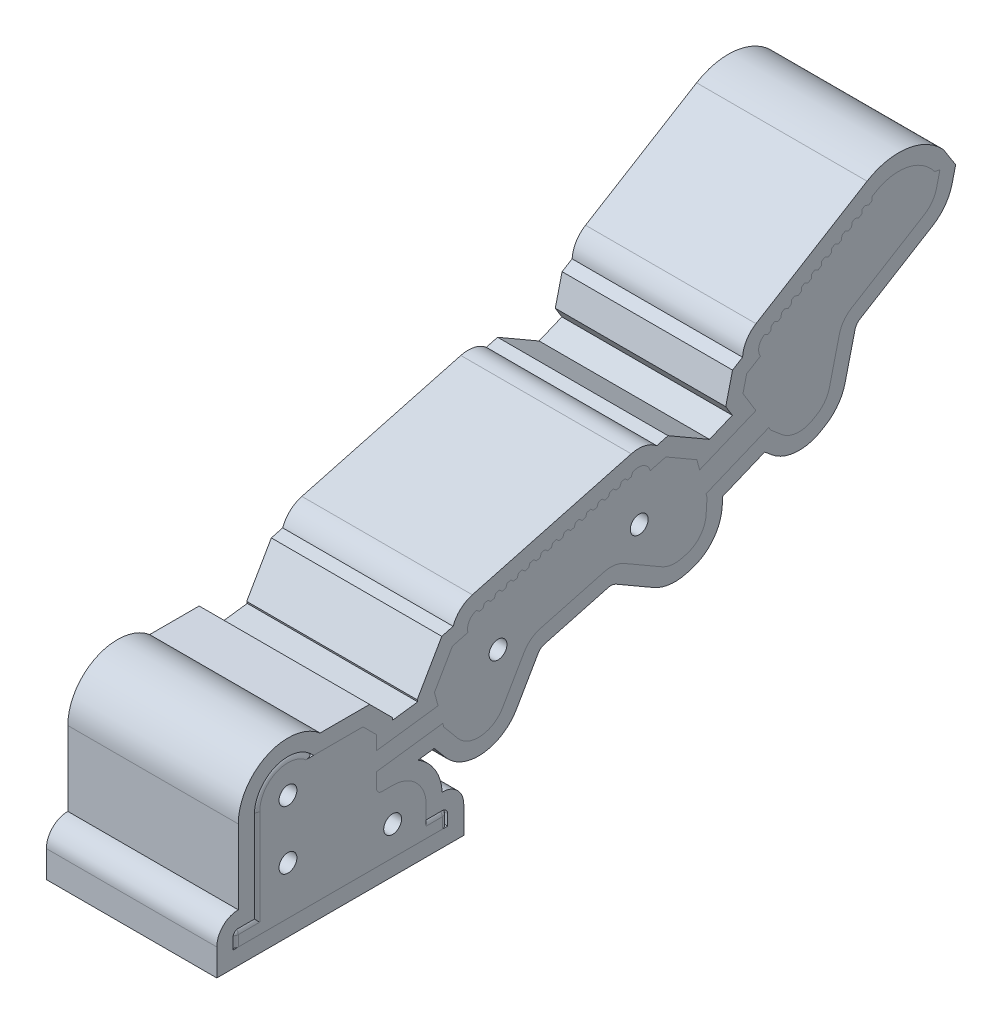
SolidWorks part; units mm, degrees
other "<finger_flexure>-<Wall Removal[3]>"
other "<finger_flexure>-<Wall Removal[2]>"
other "<finger_flexure>-<Wall Removal[1]>"
other "<finger_flexure>-<Pad Material[4]>"
other "<finger_flexure>-<Pad Material[3]>"
other "<finger_flexure>-<Pad Material[2]>"
other "<finger_flexure>-<Pad Material[1]>"
ref_plane "Front Plane" through (0, 0, 0) normal (0, 0, 1) x (1, 0, 0)
ref_plane "Top Plane" through (0, 0, 0) normal (0, 1, 0) x (1, 0, 0)
ref_plane "Right Plane" through (0, 0, 0) normal (1, 0, 0) x (0, 0, -1)
inserted part "finger_flexure"
combine bodies "Union" operation type add bodies to combine 107 103 105 102 104 106 101
sketch "Sketch2" plane through (15.875, 0, 0) normal (1, 0, 0) x (0, 0, -1)
  line L0 (116.3122, 42.9188) -> (119.2429, 42.2748) construction
  line L1 (116.9789, 45.8438) -> (119.2429, 42.2748)
  line L2 (-11.375, 2.75) -> (-11.375, -14.1005) construction
  line L3 (82.0558, 35.2325) -> (102.741, 47.8696)
  line L4 (-11.375, -14.1005) -> (-14.375, -14.1005) construction
  line L5 (-15.375, -17.1005) -> (-14.375, -17.1005) construction
  line L7 (-15.375, -15.1005) -> (-15.375, -17.1005) construction
  line L8 (23.625, -17.1005) -> (24.625, -17.1005) construction
  line L9 (24.625, -17.1005) -> (24.625, -15.1005) construction
  line L10 (118.5807, 39.5327) -> (119.2429, 42.2748)
  line L11 (101.4017, 26.2918) -> (114.9749, 34.5841)
  line L12 (98.639, 17.3484) -> (100.5002, 25.0546)
  line L13 (23.625, -14.1005) -> (20.625, -14.1005) construction
  line L14 (94.2716, 11.9344) -> (95.0333, 12.3997)
  line L15 (83.6693, 13.7193) -> (84.9456, 12.6437)
  line L16 (-11.375, 2.75) -> (-11.375, -14.1005)
  line L17 (83.6693, 13.7193) -> (83.6693, 13.7193)
  line L18 (-11.375, -14.1005) -> (-14.375, -14.1005)
  line L19 (-15.375, -17.1005) -> (-14.375, -17.1005)
  line L20 (75.8558, 10.4828) -> (83.6693, 13.7193)
  line L21 (-15.375, -15.1005) -> (-15.375, -17.1005)
  line L22 (23.625, -17.1005) -> (24.625, -17.1005)
  line L23 (24.625, -17.1005) -> (24.625, -15.1005)
  line L24 (75.8558, 10.4828) -> (75.8558, 10.4828)
  line L25 (75.7557, 8.8571) -> (75.8558, 10.4828)
  line L26 (69.0467, 1.4082) -> (69.8414, 1.6211)
  line L27 (23.625, -14.1005) -> (20.625, -14.1005)
  line L28 (56.0202, 6.2234) -> (62.9762, 2.2074)
  line L29 (42.6761, 3.2543) -> (54.5026, 6.4232)
  line L30 (37.4457, -4.6335) -> (41.4617, 2.3225)
  line L31 (32.4243, -8.4048) -> (32.588, -8.3609)
  line L32 (22.1192, -3.3059) -> (24.2215, -5.8151)
  line L33 (22.1192, -3.3059) -> (22.1192, -3.3059)
  line L34 (19.1069, -3.7025) -> (22.1192, -3.3059)
  line L35 (19.1069, -3.7025) -> (19.1069, -3.7025)
  line L36 (19.1069, -3.7025) -> (19.1069, -3.7025)
  line L37 (23.6086, -11.1005) -> (23.6086, -11.1005)
  line L38 (23.625, -11.1005) -> (23.6086, -11.1005)
  line L39 (27.625, -20.1005) -> (27.625, -15.1005)
  line L40 (23.625, -20.1005) -> (27.625, -20.1005)
  line L41 (-14.375, -20.1005) -> (23.625, -20.1005)
  line L42 (-18.375, -20.1005) -> (-14.375, -20.1005)
  line L43 (-18.375, -15.1005) -> (-18.375, -20.1005)
  line L44 (-14.375, -11.1005) -> (-14.375, -11.1005)
  line L45 (-14.375, 2.75) -> (-14.375, -11.1005)
  line L46 (10.0904, 9.8) -> (0.8633, 9.8)
  line L47 (14.375, 5.5154) -> (10.0904, 9.8)
  line L48 (14.375, 5.1153) -> (14.375, 5.5154)
  line L49 (19.0506, 5.7309) -> (14.375, 5.1153)
  line L50 (18.9471, 6.1173) -> (19.0506, 5.7309)
  line L51 (23.5324, 14.0593) -> (18.9471, 6.1173)
  line L52 (25.6421, 14.6246) -> (23.5324, 14.0593)
  line L53 (29.2214, 17.9131) -> (58.8253, 25.8454)
  line L54 (65.6791, 25.3525) -> (63.5693, 24.7872)
  line L55 (73.3989, 20.8954) -> (65.6791, 25.3525)
  line L56 (73.3989, 20.8954) -> (73.3989, 20.8954)
  line L57 (77.6453, 22.6543) -> (73.3989, 20.8954)
  line L58 (76.4172, 24.6646) -> (77.6453, 22.6543)
  line L59 (77.6883, 29.9276) -> (76.4172, 24.6646)
  line L60 (79.5522, 31.0663) -> (77.6883, 29.9276)
  line L61 (118.5807, 39.5327) -> (119.9474, 45.1915) construction
  line L141 (11.375, -4.4005) -> (11.375, -1.6945)
  line L142 (11.375, -1.6945) -> (23.7109, -0.0704)
  line L143 (23.7109, -0.0704) -> (23.8936, -0.7524)
  line L144 (23.8936, -0.7524) -> (26.5211, -3.8884)
  line L145 (31.6478, -5.507) -> (31.8116, -5.4631)
  line L146 (34.8476, -3.1335) -> (38.8636, 3.8225)
  line L147 (41.8997, 6.1521) -> (53.7261, 9.321)
  line L148 (57.5202, 8.8215) -> (64.4762, 4.8055)
  line L149 (68.2703, 4.306) -> (69.0649, 4.5189)
  line L150 (72.7614, 9.0414) -> (72.9287, 11.7598)
  line L151 (72.9287, 11.7598) -> (72.746, 12.4418)
  line L152 (72.746, 12.4418) -> (84.4406, 17.2859)
  line L153 (84.4406, 17.2859) -> (84.81, 16.6812)
  line L154 (84.81, 16.6812) -> (86.8789, 14.9378)
  line L155 (92.7076, 14.4944) -> (93.4693, 14.9598)
  line L156 (95.7229, 18.0527) -> (97.5841, 25.7589)
  line L157 (99.8376, 28.8518) -> (113.4109, 37.1441)
  line L158 (115.6645, 40.237) -> (116.3122, 42.9188)
  line L159 (116.3122, 42.9188) -> (115.3247, 43.1358)
  line L160 (104.305, 45.3096) -> (103.6736, 44.9238)
  line L161 (103.6736, 44.9238) -> (103.6317, 44.2251)
  line L162 (103.6317, 44.2251) -> (103.0344, 43.8602)
  line L163 (103.0344, 43.8602) -> (102.3936, 44.1418)
  line L164 (102.3936, 44.1418) -> (101.7962, 43.7769)
  line L165 (101.7962, 43.7769) -> (101.7544, 43.0782)
  line L166 (101.7544, 43.0782) -> (101.157, 42.7132)
  line L167 (101.157, 42.7132) -> (100.5162, 42.9949)
  line L168 (100.5162, 42.9949) -> (99.9189, 42.63)
  line L169 (99.9189, 42.63) -> (99.877, 41.9312)
  line L170 (99.877, 41.9312) -> (99.2796, 41.5663)
  line L171 (99.2796, 41.5663) -> (98.6388, 41.848)
  line L172 (98.6388, 41.848) -> (98.0415, 41.483)
  line L173 (98.0415, 41.483) -> (97.9996, 40.7843)
  line L174 (97.9996, 40.7843) -> (97.4023, 40.4193)
  line L175 (97.4023, 40.4193) -> (96.7615, 40.701)
  line L176 (96.7615, 40.701) -> (96.1641, 40.3361)
  line L177 (96.1641, 40.3361) -> (96.1222, 39.6373)
  line L178 (96.1222, 39.6373) -> (95.5249, 39.2724)
  line L179 (95.5249, 39.2724) -> (94.8841, 39.5541)
  line L180 (94.8841, 39.5541) -> (94.2867, 39.1891)
  line L181 (94.2867, 39.1891) -> (94.2449, 38.4904)
  line L182 (94.2449, 38.4904) -> (93.6475, 38.1255)
  line L183 (93.6475, 38.1255) -> (93.0067, 38.4071)
  line L184 (93.0067, 38.4071) -> (92.4094, 38.0422)
  line L185 (92.4094, 38.0422) -> (92.3675, 37.3435)
  line L186 (92.3675, 37.3435) -> (91.7702, 36.9785)
  line L187 (91.7702, 36.9785) -> (91.1293, 37.2602)
  line L188 (91.1293, 37.2602) -> (90.532, 36.8953)
  line L189 (90.532, 36.8953) -> (90.4901, 36.1965)
  line L190 (90.4901, 36.1965) -> (89.8928, 35.8316)
  line L191 (89.8928, 35.8316) -> (89.252, 36.1133)
  line L192 (89.252, 36.1133) -> (88.6546, 35.7483)
  line L193 (88.6546, 35.7483) -> (88.6128, 35.0496)
  line L194 (88.6128, 35.0496) -> (88.0154, 34.6846)
  line L195 (88.0154, 34.6846) -> (87.3746, 34.9663)
  line L196 (87.3746, 34.9663) -> (86.7772, 34.6014)
  line L197 (86.7772, 34.6014) -> (86.7354, 33.9026)
  line L198 (86.7354, 33.9026) -> (86.138, 33.5377)
  line L199 (86.138, 33.5377) -> (85.4972, 33.8194)
  line L200 (85.4972, 33.8194) -> (84.8999, 33.4545)
  line L201 (84.8999, 33.4545) -> (84.858, 32.7557)
  line L202 (84.858, 32.7557) -> (84.2607, 32.3908)
  line L203 (84.2607, 32.3908) -> (83.6198, 32.6725)
  line L204 (82.8728, 29.5794) -> (80.3127, 28.0154)
  line L205 (80.3127, 28.0154) -> (79.6251, 25.1682)
  line L206 (79.6251, 25.1682) -> (82.034, 21.225)
  line L207 (82.034, 21.225) -> (71.5555, 16.8847)
  line L208 (71.5555, 16.8847) -> (71.0449, 18.7904)
  line L209 (71.0449, 18.7904) -> (65.2552, 22.1331)
  line L210 (65.2552, 22.1331) -> (62.3575, 21.3566)
  line L211 (59.6018, 22.9476) -> (59.0722, 22.8057)
  line L212 (59.0722, 22.8057) -> (58.8346, 22.1473)
  line L213 (58.8346, 22.1473) -> (58.1584, 21.9661)
  line L214 (58.1584, 21.9661) -> (57.6234, 22.4175)
  line L215 (57.6234, 22.4175) -> (56.9472, 22.2363)
  line L216 (56.9472, 22.2363) -> (56.7095, 21.5779)
  line L217 (56.7095, 21.5779) -> (56.0334, 21.3967)
  line L218 (56.0334, 21.3967) -> (55.4983, 21.8481)
  line L219 (55.4983, 21.8481) -> (54.8222, 21.6669)
  line L220 (54.8222, 21.6669) -> (54.5845, 21.0085)
  line L221 (54.5845, 21.0085) -> (53.9083, 20.8273)
  line L222 (53.9083, 20.8273) -> (53.3733, 21.2787)
  line L223 (53.3733, 21.2787) -> (52.6971, 21.0975)
  line L224 (52.6971, 21.0975) -> (52.4594, 20.4391)
  line L225 (52.4594, 20.4391) -> (51.7833, 20.2579)
  line L226 (51.7833, 20.2579) -> (51.2482, 20.7093)
  line L227 (51.2482, 20.7093) -> (50.5721, 20.5281)
  line L228 (50.5721, 20.5281) -> (50.3344, 19.8697)
  line L229 (50.3344, 19.8697) -> (49.6583, 19.6885)
  line L230 (49.6583, 19.6885) -> (49.1232, 20.1399)
  line L231 (49.1232, 20.1399) -> (48.4471, 19.9587)
  line L232 (48.4471, 19.9587) -> (48.2094, 19.3003)
  line L233 (48.2094, 19.3003) -> (47.5332, 19.1191)
  line L234 (47.5332, 19.1191) -> (46.9982, 19.5705)
  line L235 (46.9982, 19.5705) -> (46.322, 19.3893)
  line L236 (46.322, 19.3893) -> (46.0843, 18.7309)
  line L237 (46.0843, 18.7309) -> (45.4082, 18.5497)
  line L238 (45.4082, 18.5497) -> (44.8731, 19.0011)
  line L239 (44.8731, 19.0011) -> (44.197, 18.8199)
  line L240 (44.197, 18.8199) -> (43.9593, 18.1615)
  line L241 (43.9593, 18.1615) -> (43.2832, 17.9803)
  line L242 (43.2832, 17.9803) -> (42.7481, 18.4317)
  line L243 (42.7481, 18.4317) -> (42.072, 18.2505)
  line L244 (42.072, 18.2505) -> (41.8343, 17.5921)
  line L245 (41.8343, 17.5921) -> (41.1581, 17.4109)
  line L246 (41.1581, 17.4109) -> (40.6231, 17.8623)
  line L247 (40.6231, 17.8623) -> (39.9469, 17.6811)
  line L248 (39.9469, 17.6811) -> (39.7092, 17.0227)
  line L249 (39.7092, 17.0227) -> (39.0331, 16.8415)
  line L250 (39.0331, 16.8415) -> (38.498, 17.2929)
  line L251 (38.498, 17.2929) -> (37.8219, 17.1117)
  line L252 (37.8219, 17.1117) -> (37.5842, 16.4533)
  line L253 (37.5842, 16.4533) -> (36.908, 16.2721)
  line L254 (36.908, 16.2721) -> (36.373, 16.7235)
  line L255 (36.373, 16.7235) -> (35.6968, 16.5423)
  line L256 (35.6968, 16.5423) -> (35.4592, 15.8839)
  line L257 (35.4592, 15.8839) -> (34.783, 15.7027)
  line L258 (34.783, 15.7027) -> (34.248, 16.1541)
  line L259 (34.248, 16.1541) -> (33.5718, 15.9729)
  line L260 (33.5718, 15.9729) -> (33.3341, 15.3145)
  line L261 (33.3341, 15.3145) -> (32.658, 15.1333)
  line L262 (32.658, 15.1333) -> (32.1229, 15.5847)
  line L263 (32.1229, 15.5847) -> (31.4468, 15.4035)
  line L264 (31.4468, 15.4035) -> (31.2091, 14.7451)
  line L265 (31.2091, 14.7451) -> (30.5329, 14.5639)
  line L266 (30.5329, 14.5639) -> (29.9979, 15.0153)
  line L267 (28.4069, 12.2596) -> (25.5091, 11.4831)
  line L268 (25.5091, 11.4831) -> (22.1665, 5.6935)
  line L269 (22.1665, 5.6935) -> (22.8338, 3.2031)
  line L270 (22.8338, 3.2031) -> (11.375, 1.6945)
  line L271 (11.375, 1.6945) -> (11.375, 4.2728)
  line L272 (11.375, 4.2728) -> (8.8478, 6.8)
  line L273 (8.8478, 6.8) -> (-1.7843, 6.8)
  line L274 (-10.375, 2.75) -> (-10.375, -15.1005)
  line L275 (-10.375, -15.1005) -> (-14.375, -15.1005)
  line L276 (-14.375, -15.1005) -> (-14.375, -17.1005)
  line L277 (-14.375, -17.1005) -> (23.625, -17.1005)
  line L278 (23.625, -17.1005) -> (23.625, -15.1005)
  line L279 (23.625, -15.1005) -> (20.625, -15.1005)
  line L280 (20.625, -15.1005) -> (20.625, -11.6505)
  line L281 (14.375, -5.4005) -> (12.375, -5.4005)
  line L282 (11.375, -4.4005) -> (11.375, -1.6945)
  line L283 (11.375, -1.6945) -> (23.7109, -0.0704)
  line L284 (23.7109, -0.0704) -> (23.8936, -0.7524)
  line L285 (23.8936, -0.7524) -> (26.5211, -3.8884)
  line L286 (31.6478, -5.507) -> (31.8116, -5.4631)
  line L287 (34.8476, -3.1335) -> (38.8636, 3.8225)
  line L288 (41.8997, 6.1521) -> (53.7261, 9.321)
  line L289 (57.5202, 8.8215) -> (64.4762, 4.8055)
  line L290 (68.2703, 4.306) -> (69.0649, 4.5189)
  line L291 (72.7614, 9.0414) -> (72.9287, 11.7598)
  line L292 (72.9287, 11.7598) -> (72.746, 12.4418)
  line L293 (72.746, 12.4418) -> (84.4406, 17.2859)
  line L294 (84.4406, 17.2859) -> (84.81, 16.6812)
  line L295 (84.81, 16.6812) -> (86.8789, 14.9378)
  line L296 (92.7076, 14.4944) -> (93.4693, 14.9598)
  line L297 (95.7229, 18.0527) -> (97.5841, 25.7589)
  line L298 (99.8376, 28.8518) -> (113.4109, 37.1441)
  line L299 (115.6645, 40.237) -> (116.3122, 42.9188)
  line L300 (116.3122, 42.9188) -> (115.3247, 43.1358)
  line L345 (82.8728, 29.5794) -> (80.3127, 28.0154)
  line L346 (80.3127, 28.0154) -> (79.6251, 25.1682)
  line L347 (79.6251, 25.1682) -> (82.034, 21.225)
  line L348 (82.034, 21.225) -> (71.5555, 16.8847)
  line L349 (71.5555, 16.8847) -> (71.0449, 18.7904)
  line L350 (71.0449, 18.7904) -> (65.2552, 22.1331)
  line L351 (65.2552, 22.1331) -> (62.3575, 21.3566)
  line L408 (28.4069, 12.2596) -> (25.5091, 11.4831)
  line L409 (25.5091, 11.4831) -> (22.1665, 5.6935)
  line L410 (22.1665, 5.6935) -> (22.8338, 3.2031)
  line L411 (22.8338, 3.2031) -> (11.375, 1.6945)
  line L412 (11.375, 1.6945) -> (11.375, 4.2728)
  line L413 (11.375, 4.2728) -> (8.8478, 6.8)
  line L414 (8.8478, 6.8) -> (-0.3647, 6.8)
  line L418 (-14.375, -17.1005) -> (23.625, -17.1005)
  line L421 (20.625, -14.1005) -> (20.625, -11.6505)
  line L422 (14.375, -5.4005) -> (12.375, -5.4005)
  line L423 (29.9979, 15.0153) -> (59.6018, 22.9476) construction
  line L424 (83.6198, 32.6725) -> (104.305, 45.3096) construction
  line L661 (11.375, -4.4005) -> (11.375, -1.6945)
  line L662 (11.375, -1.6945) -> (23.7109, -0.0704)
  line L663 (23.7109, -0.0704) -> (23.8936, -0.7524)
  line L664 (23.8936, -0.7524) -> (26.5211, -3.8884)
  line L665 (31.6478, -5.507) -> (31.8116, -5.4631)
  line L666 (34.8476, -3.1335) -> (38.8636, 3.8225)
  line L667 (41.8997, 6.1521) -> (53.7261, 9.321)
  line L668 (57.5202, 8.8215) -> (64.4762, 4.8055)
  line L669 (68.2703, 4.306) -> (69.0649, 4.5189)
  line L670 (72.7614, 9.0414) -> (72.9287, 11.7598)
  line L671 (72.9287, 11.7598) -> (72.746, 12.4418)
  line L672 (72.746, 12.4418) -> (84.4406, 17.2859)
  line L673 (84.4406, 17.2859) -> (84.81, 16.6812)
  line L674 (84.81, 16.6812) -> (86.8789, 14.9378)
  line L675 (92.7076, 14.4944) -> (93.4693, 14.9598)
  line L676 (95.7229, 18.0527) -> (97.5841, 25.7589)
  line L677 (99.8376, 28.8518) -> (113.4109, 37.1441)
  line L678 (115.6645, 40.237) -> (116.3122, 42.9188)
  line L679 (116.3122, 42.9188) -> (115.3247, 43.1358)
  line L680 (104.305, 45.3096) -> (103.6736, 44.9238)
  line L681 (103.6736, 44.9238) -> (103.6317, 44.2251)
  line L682 (103.6317, 44.2251) -> (103.0344, 43.8602)
  line L683 (103.0344, 43.8602) -> (102.3936, 44.1418)
  line L684 (102.3936, 44.1418) -> (101.7962, 43.7769)
  line L685 (101.7962, 43.7769) -> (101.7544, 43.0782)
  line L686 (101.7544, 43.0782) -> (101.157, 42.7132)
  line L687 (101.157, 42.7132) -> (100.5162, 42.9949)
  line L688 (100.5162, 42.9949) -> (99.9189, 42.63)
  line L689 (99.9189, 42.63) -> (99.877, 41.9312)
  line L690 (99.877, 41.9312) -> (99.2796, 41.5663)
  line L691 (99.2796, 41.5663) -> (98.6388, 41.848)
  line L692 (98.6388, 41.848) -> (98.0415, 41.483)
  line L693 (98.0415, 41.483) -> (97.9996, 40.7843)
  line L694 (97.9996, 40.7843) -> (97.4023, 40.4193)
  line L695 (97.4023, 40.4193) -> (96.7615, 40.701)
  line L696 (96.7615, 40.701) -> (96.1641, 40.3361)
  line L697 (96.1641, 40.3361) -> (96.1222, 39.6373)
  line L698 (96.1222, 39.6373) -> (95.5249, 39.2724)
  line L699 (95.5249, 39.2724) -> (94.8841, 39.5541)
  line L700 (94.8841, 39.5541) -> (94.2867, 39.1891)
  line L701 (94.2867, 39.1891) -> (94.2449, 38.4904)
  line L702 (94.2449, 38.4904) -> (93.6475, 38.1255)
  line L703 (93.6475, 38.1255) -> (93.0067, 38.4071)
  line L704 (93.0067, 38.4071) -> (92.4094, 38.0422)
  line L705 (92.4094, 38.0422) -> (92.3675, 37.3435)
  line L706 (92.3675, 37.3435) -> (91.7702, 36.9785)
  line L707 (91.7702, 36.9785) -> (91.1293, 37.2602)
  line L708 (91.1293, 37.2602) -> (90.532, 36.8953)
  line L709 (90.532, 36.8953) -> (90.4901, 36.1965)
  line L710 (90.4901, 36.1965) -> (89.8928, 35.8316)
  line L711 (89.8928, 35.8316) -> (89.252, 36.1133)
  line L712 (89.252, 36.1133) -> (88.6546, 35.7483)
  line L713 (88.6546, 35.7483) -> (88.6128, 35.0496)
  line L714 (88.6128, 35.0496) -> (88.0154, 34.6846)
  line L715 (88.0154, 34.6846) -> (87.3746, 34.9663)
  line L716 (87.3746, 34.9663) -> (86.7772, 34.6014)
  line L717 (86.7772, 34.6014) -> (86.7354, 33.9026)
  line L718 (86.7354, 33.9026) -> (86.138, 33.5377)
  line L719 (86.138, 33.5377) -> (85.4972, 33.8194)
  line L720 (85.4972, 33.8194) -> (84.8999, 33.4545)
  line L721 (84.8999, 33.4545) -> (84.858, 32.7557)
  line L722 (84.858, 32.7557) -> (84.2607, 32.3908)
  line L723 (84.2607, 32.3908) -> (83.6198, 32.6725)
  line L724 (82.8728, 29.5794) -> (80.3127, 28.0154)
  line L725 (80.3127, 28.0154) -> (79.6251, 25.1682)
  line L726 (79.6251, 25.1682) -> (82.034, 21.225)
  line L727 (82.034, 21.225) -> (71.5555, 16.8847)
  line L728 (71.5555, 16.8847) -> (71.0449, 18.7904)
  line L729 (71.0449, 18.7904) -> (65.2552, 22.1331)
  line L730 (65.2552, 22.1331) -> (62.3575, 21.3566)
  line L731 (59.6018, 22.9476) -> (59.0722, 22.8057)
  line L732 (59.0722, 22.8057) -> (58.8346, 22.1473)
  line L733 (58.8346, 22.1473) -> (58.1584, 21.9661)
  line L734 (58.1584, 21.9661) -> (57.6234, 22.4175)
  line L735 (57.6234, 22.4175) -> (56.9472, 22.2363)
  line L736 (56.9472, 22.2363) -> (56.7095, 21.5779)
  line L737 (56.7095, 21.5779) -> (56.0334, 21.3967)
  line L738 (56.0334, 21.3967) -> (55.4983, 21.8481)
  line L739 (55.4983, 21.8481) -> (54.8222, 21.6669)
  line L740 (54.8222, 21.6669) -> (54.5845, 21.0085)
  line L741 (54.5845, 21.0085) -> (53.9083, 20.8273)
  line L742 (53.9083, 20.8273) -> (53.3733, 21.2787)
  line L743 (53.3733, 21.2787) -> (52.6971, 21.0975)
  line L744 (52.6971, 21.0975) -> (52.4594, 20.4391)
  line L745 (52.4594, 20.4391) -> (51.7833, 20.2579)
  line L746 (51.7833, 20.2579) -> (51.2482, 20.7093)
  line L747 (51.2482, 20.7093) -> (50.5721, 20.5281)
  line L748 (50.5721, 20.5281) -> (50.3344, 19.8697)
  line L749 (50.3344, 19.8697) -> (49.6583, 19.6885)
  line L750 (49.6583, 19.6885) -> (49.1232, 20.1399)
  line L751 (49.1232, 20.1399) -> (48.4471, 19.9587)
  line L752 (48.4471, 19.9587) -> (48.2094, 19.3003)
  line L753 (48.2094, 19.3003) -> (47.5332, 19.1191)
  line L754 (47.5332, 19.1191) -> (46.9982, 19.5705)
  line L755 (46.9982, 19.5705) -> (46.322, 19.3893)
  line L756 (46.322, 19.3893) -> (46.0843, 18.7309)
  line L757 (46.0843, 18.7309) -> (45.4082, 18.5497)
  line L758 (45.4082, 18.5497) -> (44.8731, 19.0011)
  line L759 (44.8731, 19.0011) -> (44.197, 18.8199)
  line L760 (44.197, 18.8199) -> (43.9593, 18.1615)
  line L761 (43.9593, 18.1615) -> (43.2832, 17.9803)
  line L762 (43.2832, 17.9803) -> (42.7481, 18.4317)
  line L763 (42.7481, 18.4317) -> (42.072, 18.2505)
  line L764 (42.072, 18.2505) -> (41.8343, 17.5921)
  line L765 (41.8343, 17.5921) -> (41.1581, 17.4109)
  line L766 (41.1581, 17.4109) -> (40.6231, 17.8623)
  line L767 (40.6231, 17.8623) -> (39.9469, 17.6811)
  line L768 (39.9469, 17.6811) -> (39.7092, 17.0227)
  line L769 (39.7092, 17.0227) -> (39.0331, 16.8415)
  line L770 (39.0331, 16.8415) -> (38.498, 17.2929)
  line L771 (38.498, 17.2929) -> (37.8219, 17.1117)
  line L772 (37.8219, 17.1117) -> (37.5842, 16.4533)
  line L773 (37.5842, 16.4533) -> (36.908, 16.2721)
  line L774 (36.908, 16.2721) -> (36.373, 16.7235)
  line L775 (36.373, 16.7235) -> (35.6968, 16.5423)
  line L776 (35.6968, 16.5423) -> (35.4592, 15.8839)
  line L777 (35.4592, 15.8839) -> (34.783, 15.7027)
  line L778 (34.783, 15.7027) -> (34.248, 16.1541)
  line L779 (34.248, 16.1541) -> (33.5718, 15.9729)
  line L780 (33.5718, 15.9729) -> (33.3341, 15.3145)
  line L781 (33.3341, 15.3145) -> (32.658, 15.1333)
  line L782 (32.658, 15.1333) -> (32.1229, 15.5847)
  line L783 (32.1229, 15.5847) -> (31.4468, 15.4035)
  line L784 (31.4468, 15.4035) -> (31.2091, 14.7451)
  line L785 (31.2091, 14.7451) -> (30.5329, 14.5639)
  line L786 (30.5329, 14.5639) -> (29.9979, 15.0153)
  line L787 (28.4069, 12.2596) -> (25.5091, 11.4831)
  line L788 (25.5091, 11.4831) -> (22.1665, 5.6935)
  line L789 (22.1665, 5.6935) -> (22.8338, 3.2031)
  line L790 (22.8338, 3.2031) -> (11.375, 1.6945)
  line L791 (11.375, 1.6945) -> (11.375, 4.2728)
  line L792 (11.375, 4.2728) -> (8.8478, 6.8)
  line L793 (8.8478, 6.8) -> (-1.7843, 6.8)
  line L794 (-10.375, 2.75) -> (-10.375, -15.1005)
  line L795 (-10.375, -15.1005) -> (-14.375, -15.1005)
  line L796 (-14.375, -15.1005) -> (-14.375, -17.1005)
  line L797 (-14.375, -17.1005) -> (23.625, -17.1005)
  line L798 (23.625, -17.1005) -> (23.625, -15.1005)
  line L799 (23.625, -15.1005) -> (20.625, -15.1005)
  line L800 (20.625, -15.1005) -> (20.625, -11.6505)
  line L801 (14.375, -5.4005) -> (12.375, -5.4005)
  line L802 (11.375, -4.4005) -> (11.375, -1.6945)
  line L803 (11.375, -1.6945) -> (23.7109, -0.0704)
  line L804 (23.7109, -0.0704) -> (23.8936, -0.7524)
  line L805 (23.8936, -0.7524) -> (26.5211, -3.8884)
  line L806 (31.6478, -5.507) -> (31.8116, -5.4631)
  line L807 (34.8476, -3.1335) -> (38.8636, 3.8225)
  line L808 (41.8997, 6.1521) -> (53.7261, 9.321)
  line L809 (57.5202, 8.8215) -> (64.4762, 4.8055)
  line L810 (68.2703, 4.306) -> (69.0649, 4.5189)
  line L811 (72.7614, 9.0414) -> (72.9287, 11.7598)
  line L812 (72.9287, 11.7598) -> (72.746, 12.4418)
  line L813 (72.746, 12.4418) -> (84.4406, 17.2859)
  line L814 (84.4406, 17.2859) -> (84.81, 16.6812)
  line L815 (84.81, 16.6812) -> (86.8789, 14.9378)
  line L816 (92.7076, 14.4944) -> (93.4693, 14.9598)
  line L817 (95.7229, 18.0527) -> (97.5841, 25.7589)
  line L818 (99.8376, 28.8518) -> (113.4109, 37.1441)
  line L819 (115.6645, 40.237) -> (116.3122, 42.9188)
  line L820 (116.3122, 42.9188) -> (115.3247, 43.1358)
  line L821 (104.305, 45.3096) -> (103.6736, 44.9238)
  line L822 (103.6736, 44.9238) -> (103.6317, 44.2251)
  line L823 (103.6317, 44.2251) -> (103.0344, 43.8602)
  line L824 (103.0344, 43.8602) -> (102.3936, 44.1418)
  line L825 (102.3936, 44.1418) -> (101.7962, 43.7769)
  line L826 (101.7962, 43.7769) -> (101.7544, 43.0782)
  line L827 (101.7544, 43.0782) -> (101.157, 42.7132)
  line L828 (101.157, 42.7132) -> (100.5162, 42.9949)
  line L829 (100.5162, 42.9949) -> (99.9189, 42.63)
  line L830 (99.9189, 42.63) -> (99.877, 41.9312)
  line L831 (99.877, 41.9312) -> (99.2796, 41.5663)
  line L832 (99.2796, 41.5663) -> (98.6388, 41.848)
  line L833 (98.6388, 41.848) -> (98.0415, 41.483)
  line L834 (98.0415, 41.483) -> (97.9996, 40.7843)
  line L835 (97.9996, 40.7843) -> (97.4023, 40.4193)
  line L836 (97.4023, 40.4193) -> (96.7615, 40.701)
  line L837 (96.7615, 40.701) -> (96.1641, 40.3361)
  line L838 (96.1641, 40.3361) -> (96.1222, 39.6373)
  line L839 (96.1222, 39.6373) -> (95.5249, 39.2724)
  line L840 (95.5249, 39.2724) -> (94.8841, 39.5541)
  line L841 (94.8841, 39.5541) -> (94.2867, 39.1891)
  line L842 (94.2867, 39.1891) -> (94.2449, 38.4904)
  line L843 (94.2449, 38.4904) -> (93.6475, 38.1255)
  line L844 (93.6475, 38.1255) -> (93.0067, 38.4071)
  line L845 (93.0067, 38.4071) -> (92.4094, 38.0422)
  line L846 (92.4094, 38.0422) -> (92.3675, 37.3435)
  line L847 (92.3675, 37.3435) -> (91.7702, 36.9785)
  line L848 (91.7702, 36.9785) -> (91.1293, 37.2602)
  line L849 (91.1293, 37.2602) -> (90.532, 36.8953)
  line L850 (90.532, 36.8953) -> (90.4901, 36.1965)
  line L851 (90.4901, 36.1965) -> (89.8928, 35.8316)
  line L852 (89.8928, 35.8316) -> (89.252, 36.1133)
  line L853 (89.252, 36.1133) -> (88.6546, 35.7483)
  line L854 (88.6546, 35.7483) -> (88.6128, 35.0496)
  line L855 (88.6128, 35.0496) -> (88.0154, 34.6846)
  line L856 (88.0154, 34.6846) -> (87.3746, 34.9663)
  line L857 (87.3746, 34.9663) -> (86.7772, 34.6014)
  line L858 (86.7772, 34.6014) -> (86.7354, 33.9026)
  line L859 (86.7354, 33.9026) -> (86.138, 33.5377)
  line L860 (86.138, 33.5377) -> (85.4972, 33.8194)
  line L861 (85.4972, 33.8194) -> (84.8999, 33.4545)
  line L862 (84.8999, 33.4545) -> (84.858, 32.7557)
  line L863 (84.858, 32.7557) -> (84.2607, 32.3908)
  line L864 (84.2607, 32.3908) -> (83.6198, 32.6725)
  line L865 (82.8728, 29.5794) -> (80.3127, 28.0154)
  line L866 (80.3127, 28.0154) -> (79.6251, 25.1682)
  line L867 (79.6251, 25.1682) -> (82.034, 21.225)
  line L868 (82.034, 21.225) -> (71.5555, 16.8847)
  line L869 (71.5555, 16.8847) -> (71.0449, 18.7904)
  line L870 (71.0449, 18.7904) -> (65.2552, 22.1331)
  line L871 (65.2552, 22.1331) -> (62.3575, 21.3566)
  line L872 (59.6018, 22.9476) -> (59.0722, 22.8057)
  line L873 (59.0722, 22.8057) -> (58.8346, 22.1473)
  line L874 (58.8346, 22.1473) -> (58.1584, 21.9661)
  line L875 (58.1584, 21.9661) -> (57.6234, 22.4175)
  line L876 (57.6234, 22.4175) -> (56.9472, 22.2363)
  line L877 (56.9472, 22.2363) -> (56.7095, 21.5779)
  line L878 (56.7095, 21.5779) -> (56.0334, 21.3967)
  line L879 (56.0334, 21.3967) -> (55.4983, 21.8481)
  line L880 (55.4983, 21.8481) -> (54.8222, 21.6669)
  line L881 (54.8222, 21.6669) -> (54.5845, 21.0085)
  line L882 (54.5845, 21.0085) -> (53.9083, 20.8273)
  line L883 (53.9083, 20.8273) -> (53.3733, 21.2787)
  line L884 (53.3733, 21.2787) -> (52.6971, 21.0975)
  line L885 (52.6971, 21.0975) -> (52.4594, 20.4391)
  line L886 (52.4594, 20.4391) -> (51.7833, 20.2579)
  line L887 (51.7833, 20.2579) -> (51.2482, 20.7093)
  line L888 (51.2482, 20.7093) -> (50.5721, 20.5281)
  line L889 (50.5721, 20.5281) -> (50.3344, 19.8697)
  line L890 (50.3344, 19.8697) -> (49.6583, 19.6885)
  line L891 (49.6583, 19.6885) -> (49.1232, 20.1399)
  line L892 (49.1232, 20.1399) -> (48.4471, 19.9587)
  line L893 (48.4471, 19.9587) -> (48.2094, 19.3003)
  line L894 (48.2094, 19.3003) -> (47.5332, 19.1191)
  line L895 (47.5332, 19.1191) -> (46.9982, 19.5705)
  line L896 (46.9982, 19.5705) -> (46.322, 19.3893)
  line L897 (46.322, 19.3893) -> (46.0843, 18.7309)
  line L898 (46.0843, 18.7309) -> (45.4082, 18.5497)
  line L899 (45.4082, 18.5497) -> (44.8731, 19.0011)
  line L900 (44.8731, 19.0011) -> (44.197, 18.8199)
  line L901 (44.197, 18.8199) -> (43.9593, 18.1615)
  line L902 (43.9593, 18.1615) -> (43.2832, 17.9803)
  line L903 (43.2832, 17.9803) -> (42.7481, 18.4317)
  line L904 (42.7481, 18.4317) -> (42.072, 18.2505)
  line L905 (42.072, 18.2505) -> (41.8343, 17.5921)
  line L906 (41.8343, 17.5921) -> (41.1581, 17.4109)
  line L907 (41.1581, 17.4109) -> (40.6231, 17.8623)
  line L908 (40.6231, 17.8623) -> (39.9469, 17.6811)
  line L909 (39.9469, 17.6811) -> (39.7092, 17.0227)
  line L910 (39.7092, 17.0227) -> (39.0331, 16.8415)
  line L911 (39.0331, 16.8415) -> (38.498, 17.2929)
  line L912 (38.498, 17.2929) -> (37.8219, 17.1117)
  line L913 (37.8219, 17.1117) -> (37.5842, 16.4533)
  line L914 (37.5842, 16.4533) -> (36.908, 16.2721)
  line L915 (36.908, 16.2721) -> (36.373, 16.7235)
  line L916 (36.373, 16.7235) -> (35.6968, 16.5423)
  line L917 (35.6968, 16.5423) -> (35.4592, 15.8839)
  line L918 (35.4592, 15.8839) -> (34.783, 15.7027)
  line L919 (34.783, 15.7027) -> (34.248, 16.1541)
  line L920 (34.248, 16.1541) -> (33.5718, 15.9729)
  line L921 (33.5718, 15.9729) -> (33.3341, 15.3145)
  line L922 (33.3341, 15.3145) -> (32.658, 15.1333)
  line L923 (32.658, 15.1333) -> (32.1229, 15.5847)
  line L924 (32.1229, 15.5847) -> (31.4468, 15.4035)
  line L925 (31.4468, 15.4035) -> (31.2091, 14.7451)
  line L926 (31.2091, 14.7451) -> (30.5329, 14.5639)
  line L927 (30.5329, 14.5639) -> (29.9979, 15.0153)
  line L928 (28.4069, 12.2596) -> (25.5091, 11.4831)
  line L929 (25.5091, 11.4831) -> (22.1665, 5.6935)
  line L930 (22.1665, 5.6935) -> (22.8338, 3.2031)
  line L931 (22.8338, 3.2031) -> (11.375, 1.6945)
  line L932 (11.375, 1.6945) -> (11.375, 4.2728)
  line L933 (11.375, 4.2728) -> (8.8478, 6.8)
  line L934 (8.8478, 6.8) -> (-0.3647, 6.8)
  line L938 (-14.375, -17.1005) -> (23.625, -17.1005)
  line L941 (20.625, -14.1005) -> (20.625, -11.6505)
  line L942 (14.375, -5.4005) -> (12.375, -5.4005)
  line L943 (119.9474, 45.1915) -> (116.9789, 45.8438) construction
  arc A0 (116.9789, 45.8438) -> (102.741, 47.8696) centre (108.632, 38.2267) ccw
  arc A1 (-0.3647, 6.8) -> (-11.375, 2.75) centre (-5.125, 2.75) ccw construction
  arc A2 (-14.375, -14.1005) -> (-15.375, -15.1005) centre (-14.375, -15.1005) ccw construction
  arc A3 (24.625, -15.1005) -> (23.625, -14.1005) centre (23.625, -15.1005) ccw construction
  arc A4 (114.9749, 34.5841) -> (118.5807, 39.5327) centre (110.8043, 41.4109) ccw
  arc A5 (-0.3647, 6.8) -> (-11.375, 2.75) centre (-5.125, 2.75) ccw
  arc A6 (-14.375, -14.1005) -> (-15.375, -15.1005) centre (-14.375, -15.1005) ccw
  arc A7 (24.625, -15.1005) -> (23.625, -14.1005) centre (23.625, -15.1005) ccw
  arc A8 (101.4017, 26.2918) -> (100.5002, 25.0546) centre (102.4443, 24.5851) ccw
  arc A9 (95.0333, 12.3997) -> (98.639, 17.3484) centre (90.8626, 19.2265) ccw
  arc A10 (84.9456, 12.6437) -> (94.2716, 11.9344) centre (90.1009, 18.7612) ccw
  arc A11 (69.8414, 1.6211) -> (75.7557, 8.8571) centre (67.7708, 9.3485) ccw
  arc A12 (62.9762, 2.2074) -> (69.0467, 1.4082) centre (66.9762, 9.1356) ccw
  arc A13 (56.0202, 6.2234) -> (54.5026, 6.4232) centre (55.0202, 4.4914) ccw
  arc A14 (42.6761, 3.2543) -> (41.4617, 2.3225) centre (43.1937, 1.3225) ccw
  arc A15 (32.588, -8.3609) -> (37.4457, -4.6335) centre (30.5175, -0.6335) ccw
  arc A16 (24.2215, -5.8151) -> (32.4243, -8.4048) centre (30.3537, -0.6773) ccw
  arc A17 (26.5211, -3.8884) -> (31.6478, -5.507) centre (30.3537, -0.6773) ccw
  arc A18 (31.8116, -5.4631) -> (34.8476, -3.1335) centre (30.5175, -0.6335) ccw
  arc A19 (41.8997, 6.1521) -> (38.8636, 3.8225) centre (43.1937, 1.3225) ccw
  arc A20 (57.5202, 8.8215) -> (53.7261, 9.321) centre (55.0202, 4.4914) ccw
  arc A21 (64.4762, 4.8055) -> (68.2703, 4.306) centre (66.9762, 9.1356) ccw
  arc A22 (69.0649, 4.5189) -> (72.7614, 9.0414) centre (67.7708, 9.3485) ccw
  arc A23 (86.8789, 14.9378) -> (92.7076, 14.4944) centre (90.1009, 18.7612) ccw
  arc A24 (93.4693, 14.9598) -> (95.7229, 18.0527) centre (90.8626, 19.2265) ccw
  arc A25 (99.8376, 28.8518) -> (97.5841, 25.7589) centre (102.4443, 24.5851) ccw
  arc A26 (113.4109, 37.1441) -> (115.6645, 40.237) centre (110.8043, 41.4109) ccw
  arc A27 (115.3247, 43.1358) -> (104.305, 45.3096) centre (108.632, 38.2267) ccw
  arc A28 (83.6198, 32.6725) -> (82.8728, 29.5794) centre (84.7928, 30.7524) ccw
  arc A29 (62.3575, 21.3566) -> (59.6018, 22.9476) centre (60.1841, 20.7743) ccw
  arc A30 (29.9979, 15.0153) -> (28.4069, 12.2596) centre (30.5802, 12.8419) ccw
  arc A31 (-1.7843, 6.8) -> (-10.375, 2.75) centre (-5.125, 2.75) ccw
  arc A32 (20.625, -11.6505) -> (14.375, -5.4005) centre (14.375, -11.6505) ccw
  arc A33 (11.375, -4.4005) -> (12.375, -5.4005) centre (12.375, -4.4005) ccw
  arc A34 (26.5211, -3.8884) -> (31.6478, -5.507) centre (30.3537, -0.6773) ccw
  arc A35 (31.8116, -5.4631) -> (34.8476, -3.1335) centre (30.5175, -0.6335) ccw
  arc A36 (41.8997, 6.1521) -> (38.8636, 3.8225) centre (43.1937, 1.3225) ccw
  arc A37 (57.5202, 8.8215) -> (53.7261, 9.321) centre (55.0202, 4.4914) ccw
  arc A38 (64.4762, 4.8055) -> (68.2703, 4.306) centre (66.9762, 9.1356) ccw
  arc A39 (69.0649, 4.5189) -> (72.7614, 9.0414) centre (67.7708, 9.3485) ccw
  arc A40 (86.8789, 14.9378) -> (92.7076, 14.4944) centre (90.1009, 18.7612) ccw
  arc A41 (93.4693, 14.9598) -> (95.7229, 18.0527) centre (90.8626, 19.2265) ccw
  arc A42 (99.8376, 28.8518) -> (97.5841, 25.7589) centre (102.4443, 24.5851) ccw
  arc A43 (113.4109, 37.1441) -> (115.6645, 40.237) centre (110.8043, 41.4109) ccw
  arc A44 (115.3247, 43.1358) -> (104.305, 45.3096) centre (108.632, 38.2267) ccw
  arc A45 (83.6198, 32.6725) -> (82.8728, 29.5794) centre (84.7928, 30.7524) ccw
  arc A46 (62.3575, 21.3566) -> (59.6018, 22.9476) centre (60.1841, 20.7743) ccw
  arc A47 (29.9979, 15.0153) -> (28.4069, 12.2596) centre (30.5802, 12.8419) ccw
  arc A48 (19.1069, -3.7025) -> (19.1069, -3.7025) centre (19.1069, -3.7025) ccw
  arc A49 (20.625, -11.6505) -> (14.375, -5.4005) centre (14.375, -11.6505) ccw
  arc A50 (11.375, -4.4005) -> (12.375, -5.4005) centre (12.375, -4.4005) ccw
  arc A51 (23.6086, -11.1005) -> (19.1069, -3.7025) centre (14.375, -11.6505) ccw
  arc A52 (27.625, -15.1005) -> (23.625, -11.1005) centre (23.625, -15.1005) ccw
  arc A53 (-14.375, -11.1005) -> (-18.375, -15.1005) centre (-14.375, -15.1005) ccw
  arc A54 (0.8633, 9.8) -> (-14.375, 2.75) centre (-5.125, 2.75) ccw
  arc A55 (29.2214, 17.9131) -> (25.6421, 14.6246) centre (30.5802, 12.8419) ccw
  arc A56 (63.5693, 24.7872) -> (58.8253, 25.8454) centre (60.1841, 20.7743) ccw
  arc A57 (82.0558, 35.2325) -> (79.5522, 31.0663) centre (84.7928, 30.7524) ccw
  arc A109 (26.5211, -3.8884) -> (31.6478, -5.507) centre (30.3537, -0.6773) ccw
  arc A110 (31.8116, -5.4631) -> (34.8476, -3.1335) centre (30.5175, -0.6335) ccw
  arc A111 (41.8997, 6.1521) -> (38.8636, 3.8225) centre (43.1937, 1.3225) ccw
  arc A112 (57.5202, 8.8215) -> (53.7261, 9.321) centre (55.0202, 4.4914) ccw
  arc A113 (64.4762, 4.8055) -> (68.2703, 4.306) centre (66.9762, 9.1356) ccw
  arc A114 (69.0649, 4.5189) -> (72.7614, 9.0414) centre (67.7708, 9.3485) ccw
  arc A115 (86.8789, 14.9378) -> (92.7076, 14.4944) centre (90.1009, 18.7612) ccw
  arc A116 (93.4693, 14.9598) -> (95.7229, 18.0527) centre (90.8626, 19.2265) ccw
  arc A117 (99.8376, 28.8518) -> (97.5841, 25.7589) centre (102.4443, 24.5851) ccw
  arc A118 (113.4109, 37.1441) -> (115.6645, 40.237) centre (110.8043, 41.4109) ccw
  arc A119 (115.3247, 43.1358) -> (104.305, 45.3096) centre (108.632, 38.2267) ccw
  arc A120 (83.6198, 32.6725) -> (82.8728, 29.5794) centre (84.7928, 30.7524) ccw
  arc A121 (62.3575, 21.3566) -> (59.6018, 22.9476) centre (60.1841, 20.7743) ccw
  arc A122 (29.9979, 15.0153) -> (28.4069, 12.2596) centre (30.5802, 12.8419) ccw
  arc A123 (-1.7843, 6.8) -> (-10.375, 2.75) centre (-5.125, 2.75) ccw
  arc A124 (20.625, -11.6505) -> (14.375, -5.4005) centre (14.375, -11.6505) ccw
  arc A125 (11.375, -4.4005) -> (12.375, -5.4005) centre (12.375, -4.4005) ccw
  arc A126 (26.5211, -3.8884) -> (31.6478, -5.507) centre (30.3537, -0.6773) ccw
  arc A127 (31.8116, -5.4631) -> (34.8476, -3.1335) centre (30.5175, -0.6335) ccw
  arc A128 (41.8997, 6.1521) -> (38.8636, 3.8225) centre (43.1937, 1.3225) ccw
  arc A129 (57.5202, 8.8215) -> (53.7261, 9.321) centre (55.0202, 4.4914) ccw
  arc A130 (64.4762, 4.8055) -> (68.2703, 4.306) centre (66.9762, 9.1356) ccw
  arc A131 (69.0649, 4.5189) -> (72.7614, 9.0414) centre (67.7708, 9.3485) ccw
  arc A132 (86.8789, 14.9378) -> (92.7076, 14.4944) centre (90.1009, 18.7612) ccw
  arc A133 (93.4693, 14.9598) -> (95.7229, 18.0527) centre (90.8626, 19.2265) ccw
  arc A134 (99.8376, 28.8518) -> (97.5841, 25.7589) centre (102.4443, 24.5851) ccw
  arc A135 (113.4109, 37.1441) -> (115.6645, 40.237) centre (110.8043, 41.4109) ccw
  arc A136 (115.3247, 43.1358) -> (104.305, 45.3096) centre (108.632, 38.2267) ccw
  arc A137 (83.6198, 32.6725) -> (82.8728, 29.5794) centre (84.7928, 30.7524) ccw
  arc A138 (62.3575, 21.3566) -> (59.6018, 22.9476) centre (60.1841, 20.7743) ccw
  arc A139 (29.9979, 15.0153) -> (28.4069, 12.2596) centre (30.5802, 12.8419) ccw
  arc A141 (20.625, -11.6505) -> (14.375, -5.4005) centre (14.375, -11.6505) ccw
  arc A142 (11.375, -4.4005) -> (12.375, -5.4005) centre (12.375, -4.4005) ccw
  dimension "D2" = 3
  dimension "D1" = 0
  dimension "D3" = 0
extrude "Shell" add sketch "Sketch2" against normal up to surface (31.75 mm away) separate body contours L3 A57 L60 L59 L58 L57 L55 L54 A56 L53 A55 L52 L51 L50 L49 L48 L47 L46 A54 L45 A53 L43 L42 L41 L40 L39 A52 L38 A51 L34 L32 A16 L31 A15 L30 A14 L29 A13 L28 A12 L26 A11 L25 L20 L15 A10 L14 A9 L12 A8 L11
sketch "Sketch3" plane through (0, -7.6327, -2.0452) normal (0, -0.9659, -0.2588) x (1, 0, 0)
  line L0 (-15.875, -42.0642) -> (15.875, -42.0642) construction
  line L1 (12.875, -45.0642) -> (-12.875, -45.0642)
  line L2 (12.875, -45.0642) -> (12.875, -51.3079)
  line L3 (12.875, -51.3079) -> (-12.875, -51.3079)
  line L4 (-12.875, -45.0642) -> (-12.875, -51.3079)
  line L5 (15.875, -42.0642) -> (15.875, -54.3079) construction
  line L6 (-15.875, -54.3079) -> (15.875, -54.3079) construction
  line L7 (-15.875, -54.3079) -> (-15.875, -42.0642) construction
  dimension "D1" = 3
  dimension "D2" = 3
  dimension "D3" = 3
  dimension "D4" = 3
extrude "Cut-Extrude1" cut sketch "Sketch3" against normal up to surface (3 mm away)
sketch "Sketch4" plane through (0, -25.9659, -15.8633) normal (0, -0.8534, -0.5213) x (1, 0, 0)
  line L0 (-15.875, -100.2381) -> (15.875, -100.2381) construction
  line L1 (12.875, -103.2381) -> (-12.875, -103.2381)
  line L2 (12.875, -103.2381) -> (12.875, -113.144)
  line L3 (12.875, -113.144) -> (-12.875, -113.144)
  line L4 (-12.875, -103.2381) -> (-12.875, -113.144)
  line L5 (15.875, -100.2381) -> (15.875, -116.144) construction
  line L6 (-15.875, -116.144) -> (15.875, -116.144) construction
  line L7 (-15.875, -116.144) -> (-15.875, -100.2381) construction
  dimension "D1" = 3
  dimension "D2" = 3
  dimension "D3" = 3
  dimension "D4" = 3
extrude "Cut-Extrude2" cut sketch "Sketch4" against normal up to surface (3 mm away)
sketch "Sketch5" plane through (0, -20.1005, 0) normal (0, -1, 0) x (1, 0, 0)
  line L0 (-15.875, 18.375) -> (15.875, 18.375) construction
  line L1 (9.875, 12.375) -> (-9.875, 12.375)
  line L2 (9.875, 12.375) -> (9.875, -21.625)
  line L3 (9.875, -21.625) -> (-9.875, -21.625)
  line L4 (-9.875, 12.375) -> (-9.875, -21.625)
  line L5 (15.875, 18.375) -> (15.875, -27.625) construction
  line L6 (-15.875, -27.625) -> (15.875, -27.625) construction
  line L7 (-15.875, -27.625) -> (-15.875, 18.375) construction
  dimension "D1" = 6
  dimension "D2" = 6
  dimension "D3" = 6
  dimension "D4" = 6
extrude "Cut-Extrude3" cut sketch "Sketch5" against normal up to surface (3 mm away)
fillet "Contouring" radius 2 12 edges at (-12.875, 29.1358, -103.1797) (-12.875, 34.3001, -111.6329) (12.875, 34.3001, -111.6329) (12.875, 29.1358, -103.1797) (12.875, 5.4797, -45.1857) (-12.875, 5.4797, -45.1857) (-12.875, 7.0956, -51.2166) (12.875, 7.0956, -51.2166) (9.875, -18.6005, -21.625) (-9.875, -18.6005, -21.625) (-9.875, -18.6005, 12.375) (9.875, -18.6005, 12.375)
equation "\"D2@Sketch2\"=\"width keep@values@params_print.sldprt\""
equation "\"D1@Sketch3\"=\"width keep@values@params_print.sldprt\""
equation "\"D2@Sketch3\"=\"D1@Sketch3\""
equation "\"D3@Sketch3\"=\"D1@Sketch3\""
equation "\"D4@Sketch3\"=\"D1@Sketch3\""
equation "\"D1@Sketch4\"=\"width keep@values@params_print.sldprt\""
equation "\"D2@Sketch4\"=\"D1@Sketch4\""
equation "\"D3@Sketch4\"=\"D1@Sketch4\""
equation "\"D4@Sketch4\"=\"D1@Sketch4\""
equation "\"D1@Sketch5\"=\"width keep@values@params_print.sldprt\"*2"
equation "\"D2@Sketch5\"=\"D1@Sketch5\""
equation "\"D3@Sketch5\"=\"D1@Sketch5\""
equation "\"D4@Sketch5\"=\"D1@Sketch5\""
